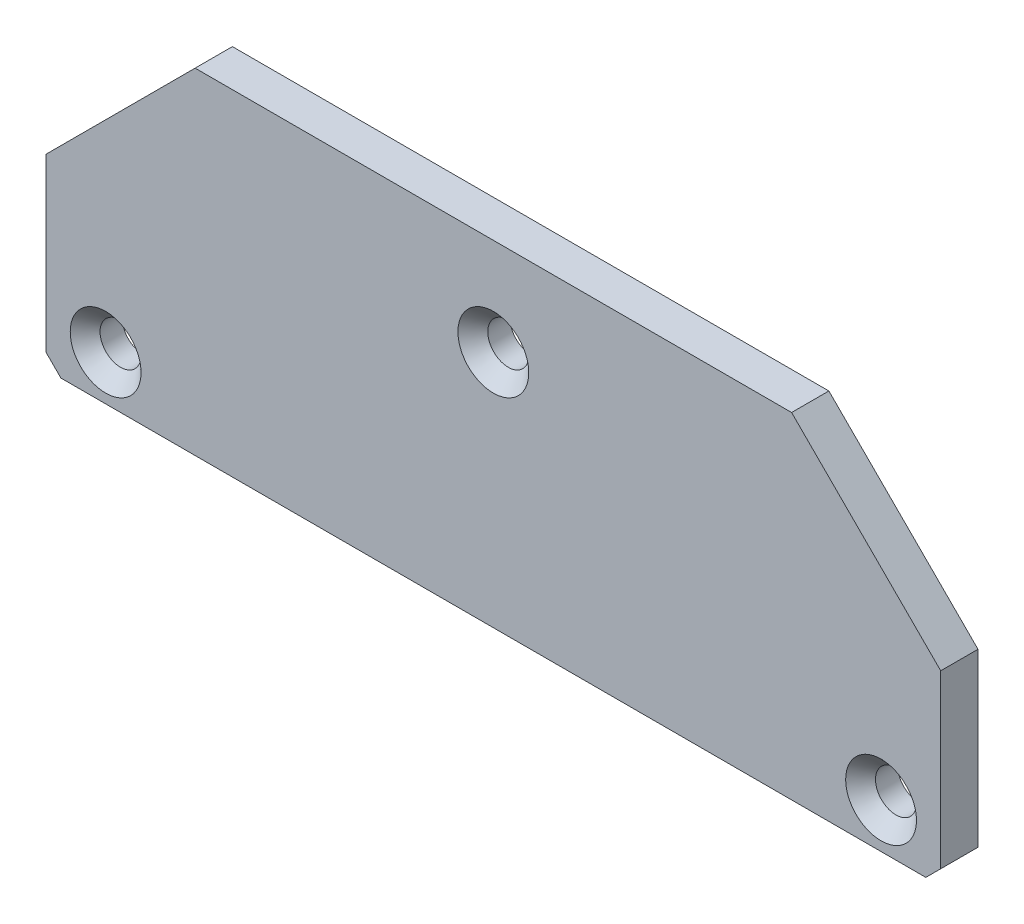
SolidWorks part; units mm, degrees
ref_plane "Plan de face" through (0, 0, 0) normal (0, 0, 1) x (1, 0, 0)
ref_plane "Plan de dessus" through (0, 0, 0) normal (0, 1, 0) x (1, 0, 0)
ref_plane "Plan de droite" through (0, 0, 0) normal (1, 0, 0) x (0, 0, -1)
sketch "Esquisse1" plane through (0, 0, -2) normal (0, 0, -1) x (-1, 0, 0)
  line L0 (-60, 37.9332) -> (-40, 57.9332)
  line L1 (-60, 37.9332) -> (-60, 12.9332)
  line L2 (-60, 12.9332) -> (60, 12.9332)
  line L3 (60, 12.9332) -> (60, 37.9332)
  line L4 (60, 37.9332) -> (40, 57.9332)
  line L5 (40, 57.9332) -> (-40, 57.9332)
  circle A0 centre (-52, 18.9332) radius 2.75
  circle A1 centre (52, 18.9332) radius 2.75
  circle A2 centre (0, 44.9332) radius 2.75
  dimension "D7" = 5.5
  dimension "D2" = 45
  dimension "D3" = 120
  dimension "D4" = 60
  dimension "D5" = 20
  dimension "D6" = 45
  dimension "D8" = 8
  dimension "D9" = 8
  dimension "D10" = 13
  dimension "D11" = 6
extrude "Boss.-Extru.1" add sketch "Esquisse1" along normal blind 5
chamfer "Chanfrein1" distance 2 angle 45 3 edges at (49.25, 18.9332, -2) (-2.75, 44.9332, -2) (-54.75, 18.9332, -2)
chamfer "Chanfrein2" distance 2 angle 45 2 edges at (60, 12.9332, -4.5) (-60, 12.9332, -4.5)
